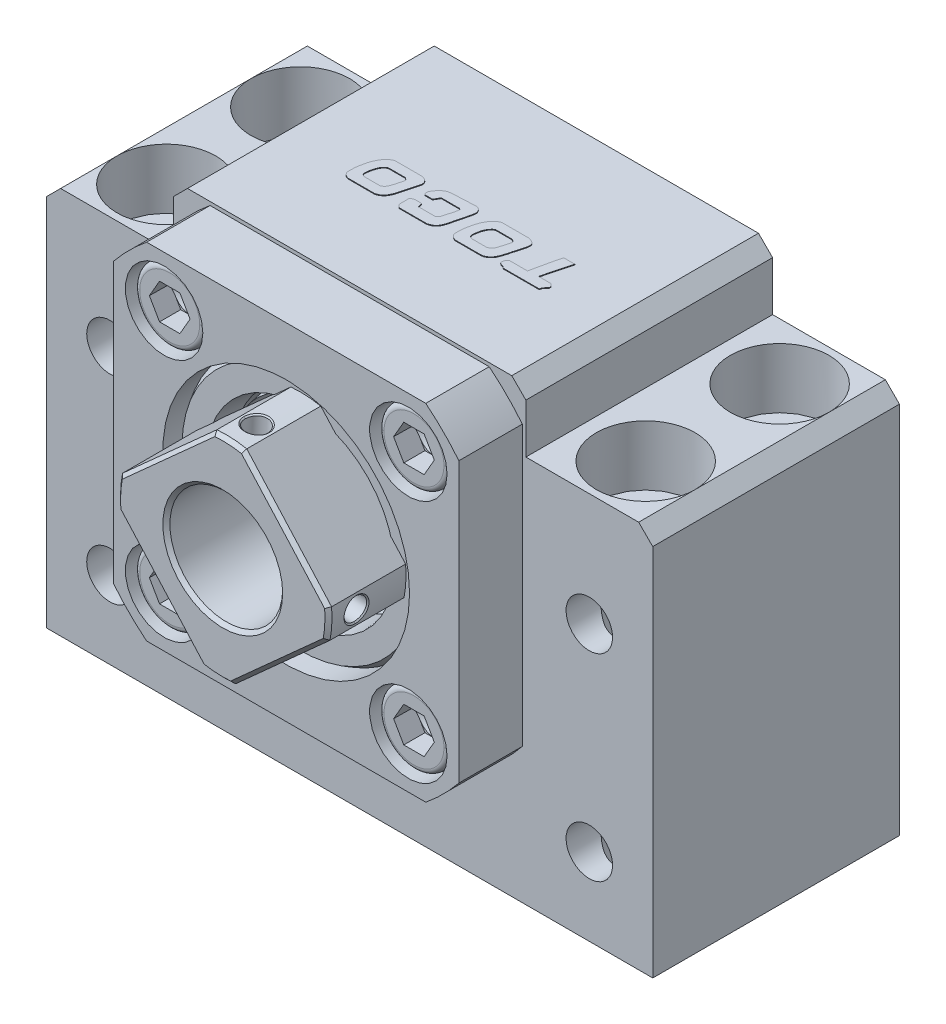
SolidWorks part; units mm, degrees
ref_plane "Front Plane" through (0, 0, 0) normal (0, 0, 1) x (1, 0, 0)
ref_plane "Top Plane" through (0, 0, 0) normal (0, 1, 0) x (1, 0, 0)
ref_plane "Right Plane" through (0, 0, 0) normal (1, 0, 0) x (0, 0, -1)
imported_body "Imported1"
imported_body "Imported2"
imported_body "Imported3"
imported_body "Imported4"
imported_body "Surface-Imported1"
imported_body "Surface-Imported2"
imported_body "Surface-Imported3"
imported_body "Surface-Imported4"
imported_body "Surface-Imported5"
imported_body "Surface-Imported6"
imported_body "Surface-Imported7"
imported_body "Surface-Imported8"
imported_body "Surface-Imported9"
imported_body "Surface-Imported10"
sketch "Sketch1" plane through (0, 0, 26.5) normal (0, 0, -1) x (-1, 0, 0)
  line L4 (25.1641, 19.3435) -> (-14.4339, 19.3435)
  line L5 (-19.1349, 14.6425) -> (-19.1349, -24.9555)
  line L6 (-14.4339, -29.6565) -> (25.1641, -29.6565)
  line L7 (29.8651, -24.9555) -> (29.8651, 14.6425)
  line L8 (25.1641, 19.3435) -> (-14.4339, 19.3435)
  line L9 (-19.1349, 14.6425) -> (-19.1349, -24.9555)
  line L10 (-14.4339, -29.6565) -> (25.1641, -29.6565)
  line L11 (29.8651, -24.9555) -> (29.8651, 14.6425)
  circle A0 centre (22.6893, -22.4806) radius 5.5
  circle A1 centre (22.6893, 12.1676) radius 5.5
  circle A2 centre (-11.959, 12.1676) radius 5.5
  circle A3 centre (-11.959, -22.4806) radius 5.5
  arc A4 (-14.4339, 19.3435) -> (-19.1349, 14.6425) centre (5.3651, -5.1565) ccw
  arc A5 (-19.1349, -24.9555) -> (-14.4339, -29.6565) centre (5.3651, -5.1565) ccw
  arc A6 (25.1641, -29.6565) -> (29.8651, -24.9555) centre (5.3651, -5.1565) ccw
  arc A7 (29.8651, 14.6425) -> (25.1641, 19.3435) centre (5.3651, -5.1565) ccw
  arc A8 (-14.4339, 19.3435) -> (-19.1349, 14.6425) centre (5.3651, -5.1565) ccw
  arc A9 (-19.1349, -24.9555) -> (-14.4339, -29.6565) centre (5.3651, -5.1565) ccw
  arc A10 (25.1641, -29.6565) -> (29.8651, -24.9555) centre (5.3651, -5.1565) ccw
  arc A11 (29.8651, 14.6425) -> (25.1641, 19.3435) centre (5.3651, -5.1565) ccw
  circle A12 centre (5.3651, -5.1565) radius 17.5
  dimension "D1" = 0
extrude "Boss-Extrude1" add sketch "Sketch1" along normal blind 10 separate body
